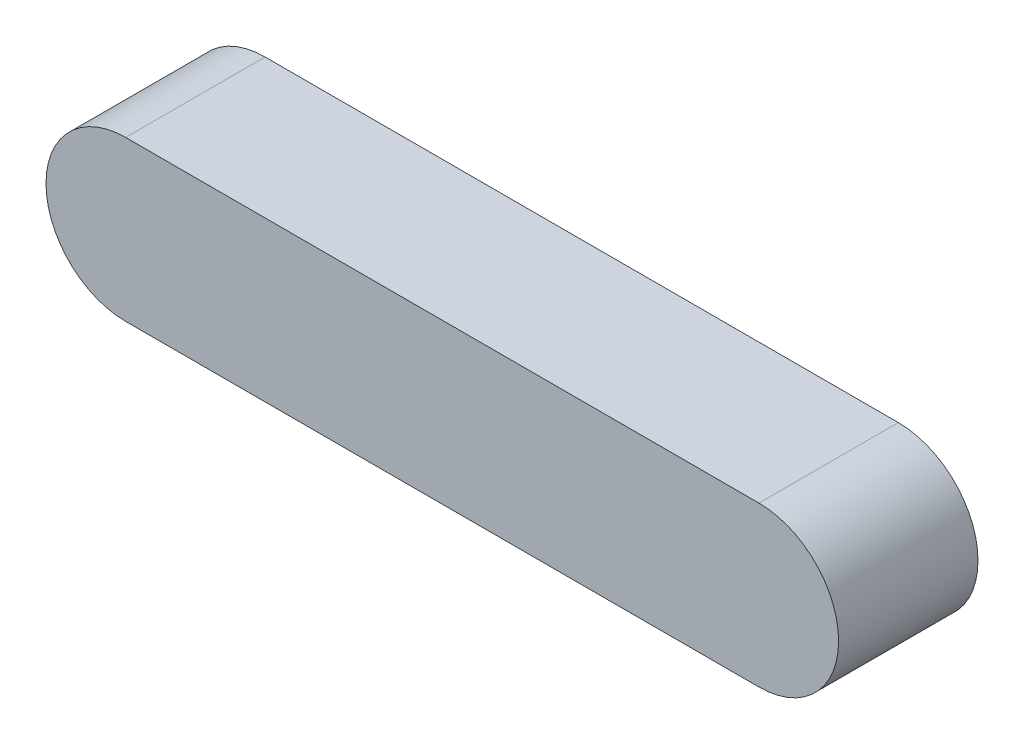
SolidWorks part; units mm, degrees
ref_plane "Plan de face" through (0, 0, 0) normal (0, 0, 1) x (1, 0, 0)
ref_plane "Plan de dessus" through (0, 0, 0) normal (0, 1, 0) x (1, 0, 0)
ref_plane "Plan de droite" through (0, 0, 0) normal (1, 0, 0) x (0, 0, -1)
sketch "Esquisse1" plane through (0, 0, 0) normal (0, 0, 1) x (1, 0, 0)
  line L0 (0, 0) -> (0, 11.2586) construction
  line L1 (0, 0) -> (46.8927, 0) construction
  line L2 (15.9, 4) -> (-15.9, 4)
  line L3 (15.9, -4) -> (-15.9, -4)
  arc A0 (15.9, -4) -> (15.9, 4) centre (15.9, 0) ccw
  arc A1 (-15.9, -4) -> (-15.9, 4) centre (-15.9, 0) cw
  point P7 (0, -4)
  point P11 (0, 4)
  dimension "D1" = 4
  dimension "D2" = 31.8
extrude "Extrusion1" add sketch "Esquisse1" along normal blind 7
